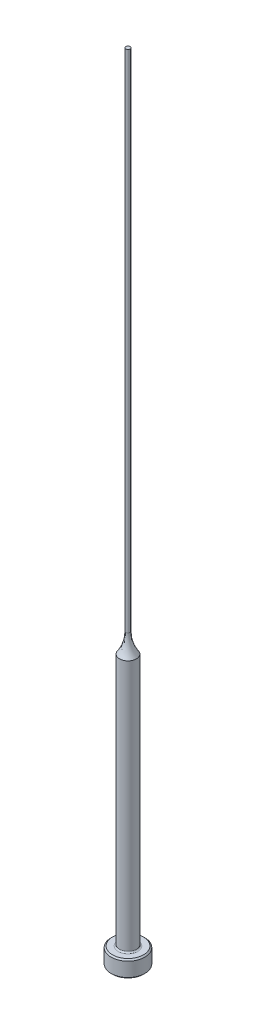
SolidWorks part; units mm, degrees
ref_plane "Front Plane" through (0, 0, 0) normal (0, 0, 1) x (1, 0, 0)
ref_plane "Top Plane" through (0, 0, 0) normal (0, 1, 0) x (1, 0, 0)
ref_plane "Right Plane" through (0, 0, 0) normal (1, 0, 0) x (0, 0, -1)
sketch "Sketch1" plane through (0, 0, 0) normal (0, 0, 1) x (1, 0, 0)
  line L0 (0, 259.9588) -> (0, -15.1925) construction
  line L1 (0, 0) -> (-3.175, 0)
  line L2 (-3.175, 0) -> (-3.175, 3.175)
  line L3 (-3.175, 3.175) -> (-1.5875, 3.175)
  line L4 (-0.3962, 54.5027) -> (-0.3962, 149.733)
  line L5 (-0.3962, 149.733) -> (0, 149.733)
  line L6 (0, 149.733) -> (0, 0)
  line L7 (-1.5875, 3.175) -> (-1.5875, 50.8)
  arc A0 (-1.5875, 50.8) -> (-0.3962, 54.5027) centre (-6.7462, 54.5027) ccw
  point P13 (-1.5875, 0)
  dimension "D1" = 6.35
  dimension "L" = 149.733
  dimension "D2" = 3.175
  dimension "H" = 6.35
  dimension "T" = 3.175
  dimension "D" = 0.7925
  dimension "S" = 50.8
revolve "Revolve1" add sketch "Sketch1" angle 360 about L0
chamfer "Chamfer1" distance 0.254 angle 45 2 edges at (0, 3.175, 3.175) (0, 0, 3.175)
fillet "Fillet1" radius 0.254 1 edges at (0, 3.175, 1.5875)
